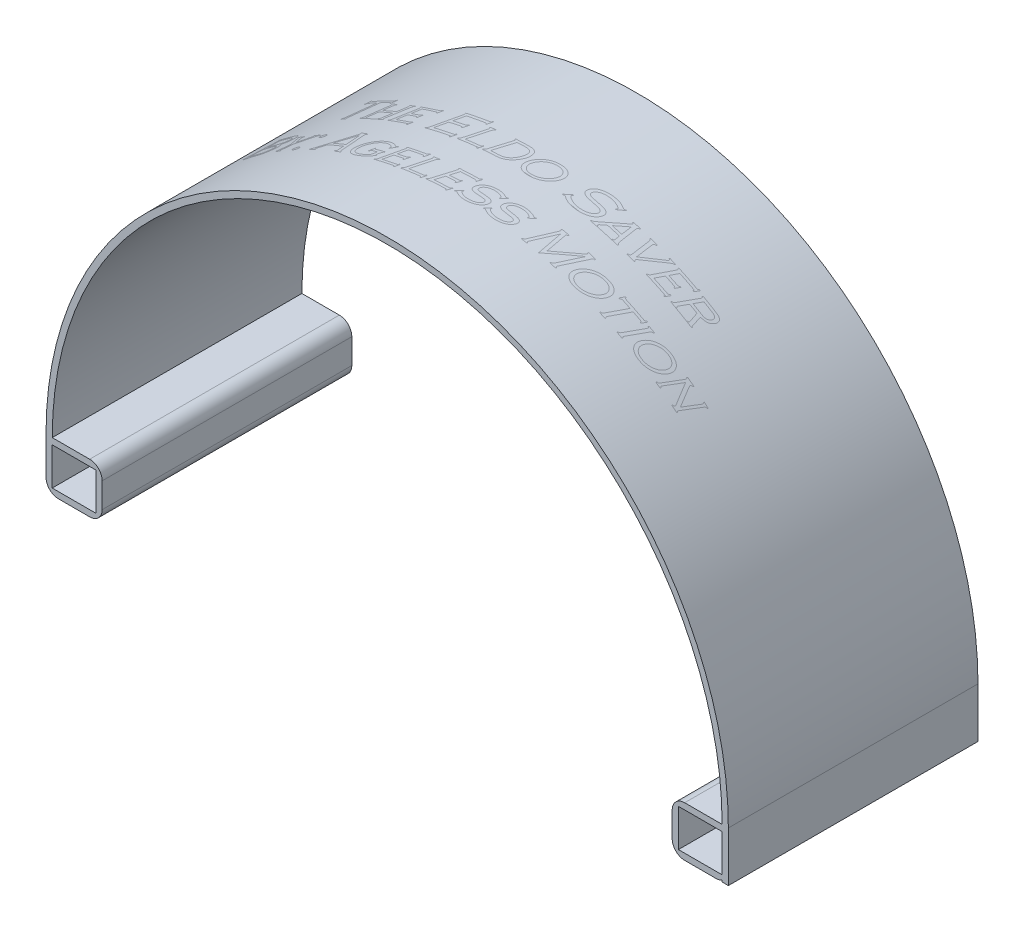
SolidWorks part; units mm, degrees
ref_plane "Front Plane" through (0, 0, 0) normal (0, 0, 1) x (1, 0, 0)
ref_plane "Top Plane" through (0, 0, 0) normal (0, 1, 0) x (1, 0, 0)
ref_plane "Right Plane" through (0, 0, 0) normal (1, 0, 0) x (0, 0, -1)
sketch "Sketch1" plane through (0, 0, 0) normal (0, 0, 1) x (1, 0, 0)
  line L0 (-80.5, 0) -> (80.5, 0) construction
  line L1 (-80.5, 0) -> (-82, 0)
  line L2 (80.5, 0) -> (82, 0)
  arc A0 (80.5, 0) -> (-80.5, 0) centre (0, 0) ccw
  arc A1 (82, 0) -> (-82, 0) centre (0, 0) ccw
extrude "Boss-Extrude2" add sketch "Sketch1" along normal mid plane 60
ref_plane "Plane1" through (0, 150, 0) normal (0, 1, 0) x (1, 0, 0)
sketch "Sketch3" plane through (0, 150, 0) normal (0, 1, 0) x (1, 0, 0)
  line L0 (-115.5974, 0) -> (115.5974, 0)
  text T0 "<i>The Eldo Saver</i>  <i>By: Ageless Motion</i>" font "Copperplate Gothic Light" height in points 36
  point P4 (0, 0)
wrap "Wrap1" sketch "Sketch3" wrap type scribe source sketch "Sketch3"
sketch "Sketch4" plane through (0, 0, 0) normal (0, -1, 0) x (1, 0, 0)
  line L1 (-82, 30) -> (-80.5, 30)
  line L2 (-82, 30) -> (-82, -30)
  line L3 (-82, -30) -> (-80.5, -30)
  line L4 (-80.5, 30) -> (-80.5, -30)
  line L5 (80.5, 30) -> (82, 30)
  line L6 (80.5, 30) -> (80.5, -30)
  line L7 (80.5, -30) -> (82, -30)
  line L8 (82, 30) -> (82, -30)
extrude "Boss-Extrude3" add sketch "Sketch4" along normal blind 12
sketch "Sketch5" plane through (80.5, 0, 0) normal (-1, 0, 0) x (0, 0, 1)
  line L0 (30, -12) -> (30, 0) construction
  line L1 (-30, -12) -> (30, -12)
  line L2 (-30, -12) -> (-30, -10.5)
  line L3 (-30, -10.5) -> (30, -10.5)
  line L4 (30, -12) -> (30, -10.5)
  dimension "D1" = 1.5
extrude "Boss-Extrude4" add sketch "Sketch5" along normal blind 12
sketch "Sketch6" plane through (0, -10.5, 0) normal (0, 1, 0) x (1, 0, 0)
  line L0 (-82, -30) -> (82, -30) construction
  line L1 (68.5, 30) -> (70, 30)
  line L2 (68.5, 30) -> (68.5, -30)
  line L3 (68.5, -30) -> (70, -30)
  line L4 (70, 30) -> (70, -30)
  dimension "D1" = 1.5
extrude "Boss-Extrude5" add sketch "Sketch6" along normal blind 10.5
sketch "Sketch9" plane through (70, 0, 0) normal (1, 0, 0) x (0, 0, -1)
  line L0 (30, -12) -> (30, 0) construction
  line L1 (-30, 0) -> (30, 0)
  line L2 (-30, 0) -> (-30, -1.5)
  line L3 (-30, -1.5) -> (30, -1.5)
  line L4 (30, 0) -> (30, -1.5)
  dimension "D1" = 1.5
extrude "Boss-Extrude6" add sketch "Sketch9" along normal up to next
fillet "Fillet1" radius 3 3 edges at (68.5, -12, 0) (82, -12, 0) (68.5, 0, 0)
mirror "Mirror11" about plane through (0, 0, 0) normal (1, 0, 0) of "Boss-Extrude3", "Boss-Extrude4", "Boss-Extrude5", "Boss-Extrude6"
fillet "Fillet3" radius 3 3 edges at (-82, -12, 0) (-68.5, -12, 0) (-68.5, 0, 0)
equation "\"userHeight\"= 1610mm"
equation "\"velcro_inner_radius\"= \"userHeight\" / 20'velcro inner radius"
equation "\"D1@Sketch1\"=\"velcro_inner_radius\""
